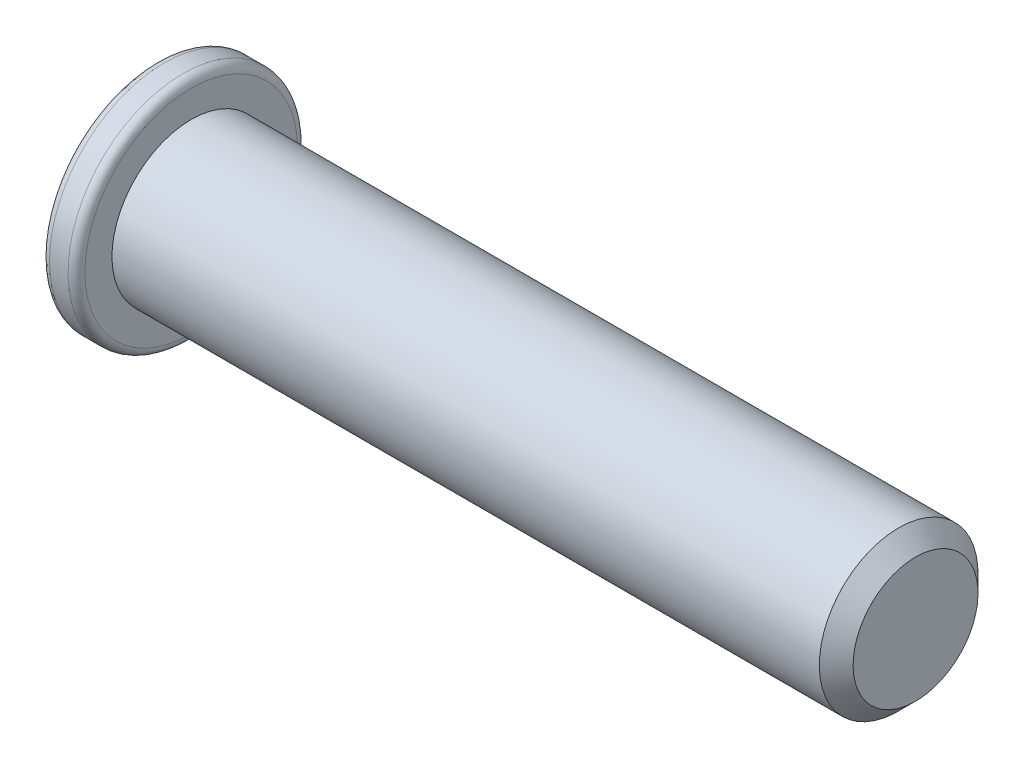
SolidWorks part; units mm, degrees
ref_plane "Front Plane" through (0, 0, 0) normal (0, 0, 1) x (1, 0, 0)
ref_plane "Top Plane" through (0, 0, 0) normal (0, 1, 0) x (1, 0, 0)
ref_plane "Right Plane" through (0, 0, 0) normal (1, 0, 0) x (0, 0, -1)
sketch "Sketch1" plane through (0, 0, 0) normal (0, 0, 1) x (1, 0, 0)
  line L0 (0, 0) -> (0, 6.8)
  line L1 (0, 6.8) -> (2.1, 6.8)
  line L2 (2.1, 6.8) -> (2.1, 4.7)
  line L3 (2.1, 4.7) -> (45, 4.7)
  line L4 (45, 4.7) -> (45, 0)
  line L5 (45, 0) -> (0, 0)
  dimension "D1" = 6.8
  dimension "D2" = 2.1
  dimension "D3" = 45
  dimension "D4" = 4.7
revolve "Revolve1" add sketch "Sketch1" angle 360 about L5
chamfer "Chamfer1" distance 1 angle 45 1 edges at (45, 4.7, 0)
fillet "Fillet1" radius 0.5 2 edges at (2.1, 6.8, 0) (0, 6.8, 0)
